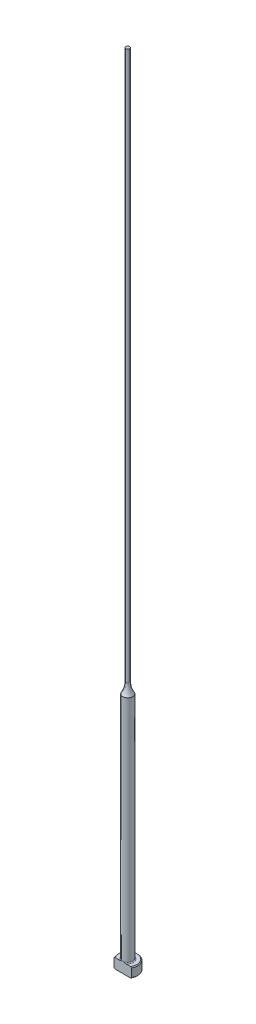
SolidWorks part; units mm, degrees
ref_plane "Front Plane" through (0, 0, 0) normal (0, 0, 1) x (1, 0, 0)
ref_plane "Top Plane" through (0, 0, 0) normal (0, 1, 0) x (1, 0, 0)
ref_plane "Right Plane" through (0, 0, 0) normal (1, 0, 0) x (0, 0, -1)
sketch "Sketch1" plane through (0, 0, 0) normal (0, 0, 1) x (1, 0, 0)
  line L0 (0, 259.9588) -> (0, -15.1925) construction
  line L1 (0, 0) -> (-3.175, 0)
  line L2 (-3.175, 0) -> (-3.175, 3.175)
  line L3 (-3.175, 3.175) -> (-1.5875, 3.175)
  line L4 (-0.5944, 79.6098) -> (-0.5944, 254)
  line L5 (-0.5944, 254) -> (0, 254)
  line L6 (0, 254) -> (0, 0)
  line L7 (-1.5875, 3.175) -> (-1.5875, 76.2)
  arc A0 (-1.5875, 76.2) -> (-0.5944, 79.6098) centre (-6.9444, 79.6098) ccw
  point P13 (-1.5875, 0)
  dimension "D1" = 6.35
  dimension "L" = 254
  dimension "D2" = 3.175
  dimension "H" = 6.35
  dimension "T" = 3.175
  dimension "D" = 1.1887
  dimension "S" = 76.2
revolve "Revolve1" add sketch "Sketch1" angle 360 about L0
chamfer "Chamfer1" distance 0.254 angle 45 2 edges at (0, 3.175, 3.175) (0, 0, 3.175)
fillet "Fillet1" radius 0.254 1 edges at (0, 3.175, 1.5875)
sketch "Sketch2" plane through (0, 0, 0) normal (0, -1, 0) x (1, 0, 0)
  line L0 (-2.7496, 1.5875) -> (2.7496, 1.5875)
  circle A0 centre (0, 0) radius 3.175 construction
  arc A1 (2.7496, 1.5875) -> (-2.7496, 1.5875) centre (0, 0) ccw
  circle A4 centre (0, 0) radius 1.5875 construction
  dimension "D1" = 0
extrude "KEY" cut sketch "Sketch2" against normal through all
